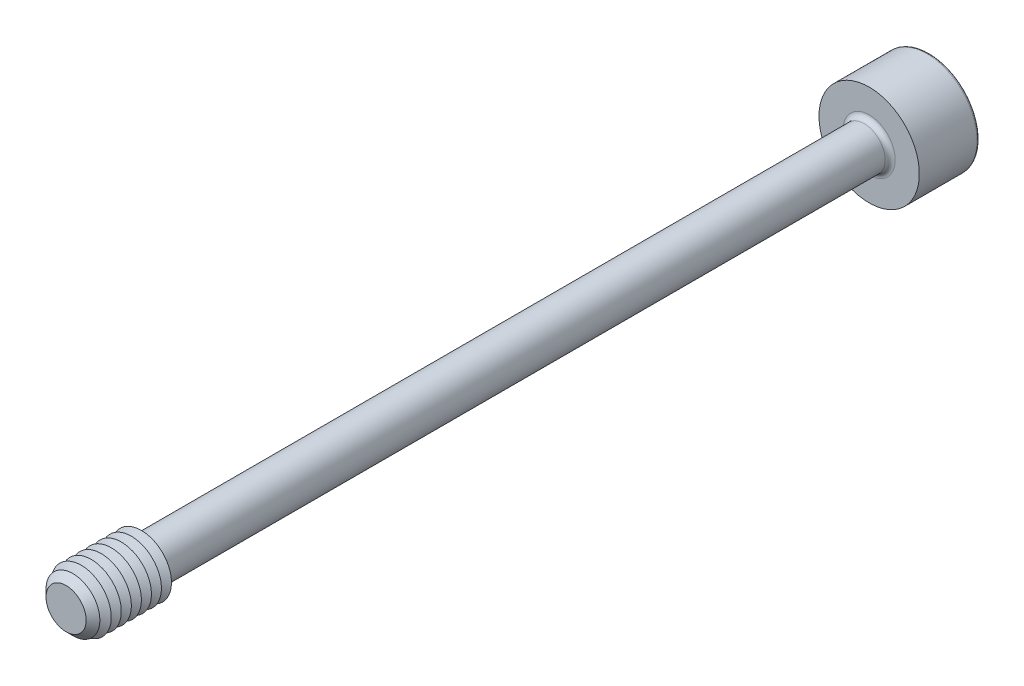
SolidWorks part; units mm, degrees
ref_plane "Front Plane" through (0, 0, 0) normal (0, 0, 1) x (1, 0, 0)
ref_plane "Top Plane" through (0, 0, 0) normal (0, 1, 0) x (1, 0, 0)
ref_plane "Right Plane" through (0, 0, 0) normal (1, 0, 0) x (0, 0, -1)
sketch "Sketch1" plane through (0, 0, 0) normal (0, 0, 1) x (1, 0, 0)
  circle A0 centre (0, 0) radius 2.1
  dimension "D1" = 4.2
extrude "Extrude1" add sketch "Sketch1" along normal mid plane 80
sketch "Sketch2" plane through (0, 0, 0) normal (1, 0, 0) x (0, 0, -1)
  line L0 (-40, 0) -> (-40, 3)
  line L1 (-40, 2.1) -> (-40, -2.1) construction
  line L2 (-40, 3) -> (-32.5, 3)
  line L3 (-32.5, 3) -> (-31.9804, 2.1)
  line L4 (40, 2.1) -> (-40, 2.1) construction
  line L5 (-31.9804, 2.1) -> (-31.9804, 0)
  line L6 (-31.9804, 0) -> (-40, 0)
  dimension "D1" = 3
  dimension "D2" = 120
  dimension "D3" = 7.5
revolve "Revolve1" add sketch "Sketch2" angle 360 about L6
chamfer "Chamfer1" distance 1 angle 45 1 edges at (0, 3, 40)
sketch "Sketch3" plane through (0, 0, -40) normal (0, 0, -1) x (-1, 0, 0)
  circle A0 centre (0, 0) radius 5
  dimension "D1" = 10
extrude "Extrude2" add sketch "Sketch3" along normal blind 6
sketch "Sketch4" plane through (-13.7, 0, -46) normal (0, 0, 1) x (1, 0, 0)
  line L2 (12.2566, -2.5) -> (15.1434, -2.5)
  line L3 (15.1434, -2.5) -> (16.5868, 0)
  line L4 (16.5868, 0) -> (15.1434, 2.5)
  line L6 (15.1434, 2.5) -> (12.2566, 2.5)
  line L7 (12.2566, 2.5) -> (10.8132, 0)
  line L8 (10.8132, 0) -> (12.2566, -2.5)
  circle A0 centre (13.7, 0) radius 2.5 construction
  dimension "D1" = 5
extrude "Extrude3" cut sketch "Sketch4" along normal blind 5
fillet "Fillet1" radius 0.5 1 edges at (-2.1, 0, -40)
fillet "Fillet2" radius 0.25 1 edges at (-5, 0, -46)
sketch "Sketch5" plane through (0, 0, 0) normal (1, 0, 0) x (0, 0, -1)
  line L0 (41, 0) -> (41, -2.5)
  line L1 (41, -2.5) -> (39.5566, 0)
  line L2 (39.5566, 0) -> (41, 0)
  dimension "D1" = 30
revolve "Cut-Revolve1" cut sketch "Sketch5" angle 360 about L2
sketch "Sketch6" plane through (0, 0, 0) normal (1, 0, 0) x (0, 0, -1)
  line L0 (1.332, 0) -> (-13.289, 0) construction
sketch "Sketch7" plane through (0, 0, 0) normal (1, 0, 0) x (0, 0, -1)
  line L0 (-32.5, 3) -> (-33, 2.134)
  line L1 (-33, 2.134) -> (-33.5, 3)
  line L2 (-32.5, 3) -> (-39, 3) construction
  line L3 (-33.5, 3) -> (-32.5, 3)
  dimension "D1" = 1
revolve "Cut-Revolve2" cut sketch "Sketch7" angle 360 about L0
pattern_linear "LPattern1" count 7 spacing 1 along (0, 0, 1) of "Cut-Revolve2"
